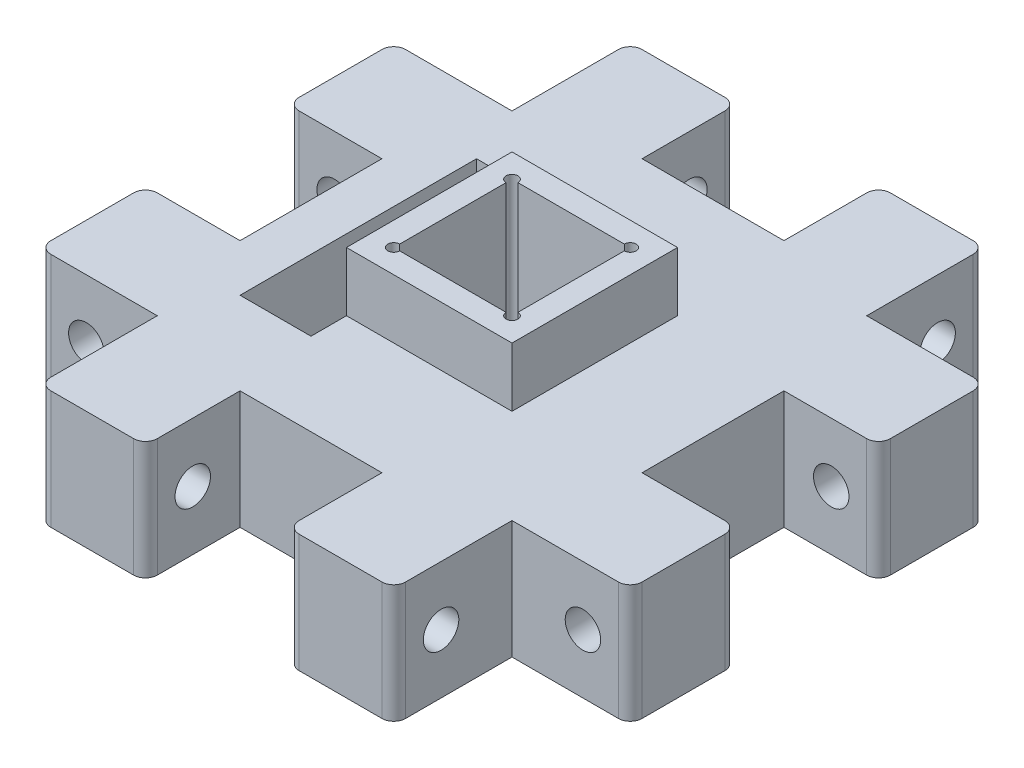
SolidWorks part; units mm, degrees
ref_plane "Front" through (0, 0, 0) normal (0, 0, 1) x (1, 0, 0)
ref_plane "Top" through (0, 0, 0) normal (0, 1, 0) x (1, 0, 0)
ref_plane "Right" through (0, 0, 0) normal (1, 0, 0) x (0, 0, -1)
sketch "草图1" plane through (0, 0, 0) normal (0, 1, 0) x (1, 0, 0)
  line L1 (-25, -25) -> (25, -25)
  line L2 (-25, -25) -> (-25, 25)
  line L3 (-25, 25) -> (25, 25)
  line L4 (25, -25) -> (25, 25)
  line L5 (-25, -25) -> (25, 25) construction
  line L6 (-25, 25) -> (25, -25) construction
  line L7 (-5, -5) -> (5, -5)
  line L8 (-5, -5) -> (-5, 5)
  line L9 (-5, 5) -> (5, 5)
  line L10 (5, -5) -> (5, 5)
  line L11 (-5, -5) -> (5, 5) construction
  line L12 (-5, 5) -> (5, -5) construction
  point P0 (0, 0)
  point P5 (0, 0)
  dimension "D1" = 50
  dimension "D2" = 50
  dimension "D3" = 10
  dimension "D4" = 10
extrude "凸台-拉伸1" add sketch "草图1" along normal blind 10
sketch "草图2" plane through (0, 10, 0) normal (0, 1, 0) x (1, 0, 0)
  line L0 (25, 6) -> (17, 6)
  line L1 (25, -25) -> (25, 25) construction
  line L2 (17, 6) -> (17, -6)
  line L3 (17, -6) -> (25, -6)
  line L4 (25, 25) -> (-25, 25) construction
  line L5 (-6, 25) -> (-6, 17)
  line L6 (6, 17) -> (6, 25)
  line L7 (-6, 17) -> (6, 17)
  line L8 (-25, -6) -> (-17, -6)
  line L9 (-17, 6) -> (-25, 6)
  line L10 (-17, -6) -> (-17, 6)
  line L11 (6, -25) -> (6, -17)
  line L12 (-6, -17) -> (-6, -25)
  line L13 (6, -17) -> (-6, -17)
  point P23 (0, 0)
  dimension "D1" = 8
  dimension "D2" = 12
  dimension "D3" = 19
  dimension "D4" = 4
extrude "切除-拉伸1" cut sketch "草图2" against normal up to next contours L5 L7 L6 M14 | L2 L3 L0 M13 | L11 L13 L12 M16 | L8 L10 L9 M15
sketch "草图4" plane through (-25, 0, 0) normal (-1, 0, 0) x (0, 0, 1)
  line L0 (-25, 10) -> (-6, 10) construction
  line L1 (-25, 10) -> (-25, 0) construction
  circle A0 centre (-21, 5) radius 1.5
  dimension "D1" = 3
  dimension "D2" = 5
  dimension "D3" = 4
extrude "切除-拉伸2" cut sketch "草图4" against normal up to surface (50 mm away)
sketch "草图5" plane through (0, 0, -25) normal (0, 0, -1) x (-1, 0, 0)
  line L0 (6, 0) -> (25, 0) construction
  line L1 (25, 10) -> (25, 0) construction
  circle A0 centre (21, 5) radius 1.5
  dimension "D1" = 5
  dimension "D2" = 4
  dimension "D3" = 3
extrude "切除-拉伸3" cut sketch "草图5" against normal up to surface (50 mm away)
sketch "草图6" plane through (-25, 0, 0) normal (-1, 0, 0) x (0, 0, 1)
  line L0 (6, 0) -> (25, 0) construction
  line L1 (25, 10) -> (25, 0) construction
  circle A0 centre (21, 5) radius 1.5
  dimension "D1" = 5
  dimension "D2" = 4
  dimension "D3" = 3
extrude "切除-拉伸4" cut sketch "草图6" against normal up to surface (50 mm away)
sketch "草图7" plane through (0, 0, 25) normal (0, 0, 1) x (1, 0, 0)
  line L0 (6, 0) -> (25, 0) construction
  line L1 (25, 10) -> (25, 0) construction
  circle A0 centre (21, 5) radius 1.5
  dimension "D1" = 5
  dimension "D2" = 4
  dimension "D3" = 3
extrude "切除-拉伸5" cut sketch "草图7" against normal up to surface (50 mm away)
sketch "草图8" plane through (0, 0, 0) normal (0, -1, 0) x (1, 0, 0)
  line L0 (-5, -5) -> (-5, 5) construction
  line L1 (-13, 10) -> (-7, 10)
  line L2 (-7, 10) -> (-7, -10)
  line L3 (-7, -10) -> (-13, -10)
  line L4 (-13, 10) -> (-13, -10)
  line L7 (-25, 25) -> (-6, 25) construction
  dimension "D1" = 20
  dimension "D2" = 2
  dimension "D3" = 6
  dimension "D4" = 15
extrude "切除-拉伸6" cut sketch "草图8" against normal up to next
sketch "草图9" plane through (0, 0, 0) normal (0, -1, 0) x (-1, 0, 0)
  circle A0 centre (-5, -5) radius 0.5
  circle A1 centre (-5, 5) radius 0.5
  circle A2 centre (5, 5) radius 0.5
  circle A3 centre (5, -5) radius 0.5
  dimension "D1" = 1
  dimension "D2" = 1
  dimension "D3" = 1
  dimension "D4" = 1
extrude "切除-拉伸7" cut sketch "草图9" against normal up to next
sketch "草图10" plane through (0, 10, 0) normal (0, 1, 0) x (1, 0, 0)
  line L0 (4.5, 5) -> (-4.5, 5) construction
  line L1 (-5, 4.5) -> (-5, -4.5) construction
  line L2 (-4.5, -5) -> (4.5, -5) construction
  line L3 (5, -4.5) -> (5, 4.5) construction
  line L4 (4.5, 5) -> (-4.5, 5)
  line L5 (-5, 4.5) -> (-5, -4.5)
  line L6 (-4.5, -5) -> (4.5, -5)
  line L7 (5, -4.5) -> (5, 4.5)
  line L9 (7, 7) -> (-7, 7)
  line L10 (7, 7) -> (7, -7)
  line L11 (7, -7) -> (-7, -7)
  line L12 (-7, 7) -> (-7, -7)
  line L13 (7, 7) -> (-7, -7) construction
  line L14 (7, -7) -> (-7, 7) construction
  arc A0 (5, 4.5) -> (4.5, 5) centre (5, 5) ccw construction
  arc A1 (-4.5, 5) -> (-5, 4.5) centre (-5, 5) ccw construction
  arc A2 (-5, -4.5) -> (-4.5, -5) centre (-5, -5) ccw construction
  arc A3 (4.5, -5) -> (5, -4.5) centre (5, -5) ccw construction
  arc A4 (5, 4.5) -> (4.5, 5) centre (5, 5) ccw
  arc A5 (-4.5, 5) -> (-5, 4.5) centre (-5, 5) ccw
  arc A6 (-5, -4.5) -> (-4.5, -5) centre (-5, -5) ccw
  arc A7 (4.5, -5) -> (5, -4.5) centre (5, -5) ccw
  point P11 (0, 0)
  dimension "D1" = 14
  dimension "D2" = 14
extrude "凸台-拉伸2" add sketch "草图10" along normal blind 5
sketch "草图12" plane through (0, 0, 0) normal (0, -1, 0) x (1, 0, 0)
  line L1 (-25, 25) -> (-15, 25)
  line L2 (-25, 25) -> (-25, 15)
  line L3 (-25, 15) -> (-15, 15)
  line L4 (-15, 25) -> (-15, 15)
  line L5 (25, 25) -> (15, 25)
  line L6 (25, 25) -> (25, 15)
  line L7 (25, 15) -> (15, 15)
  line L8 (15, 25) -> (15, 15)
  line L9 (25, -25) -> (15, -25)
  line L10 (25, -25) -> (25, -15)
  line L11 (25, -15) -> (15, -15)
  line L12 (15, -25) -> (15, -15)
  line L13 (-25, -25) -> (-15, -25)
  line L14 (-25, -25) -> (-25, -15)
  line L15 (-25, -15) -> (-15, -15)
  line L16 (-15, -25) -> (-15, -15)
  dimension "D1" = 10
  dimension "D2" = 10
  dimension "D3" = 10
  dimension "D4" = 10
  dimension "D5" = 10
  dimension "D6" = 10
  dimension "D7" = 10
  dimension "D8" = 10
extrude "切除-拉伸8" cut sketch "草图12" against normal up to next
fillet "圆角2" radius 1 16 edges at (-25, 5, -6) (-25, 5, -15) (-15, 5, -25) (-6, 5, -25) (6, 5, -25) (15, 5, -25) (25, 5, -15) (25, 5, -6) (25, 5, 6) (25, 5, 15) (15, 5, 25) (6, 5, 25) (-6, 5, 25) (-25, 5, 6) (-25, 5, 15) (-15, 5, 25)
